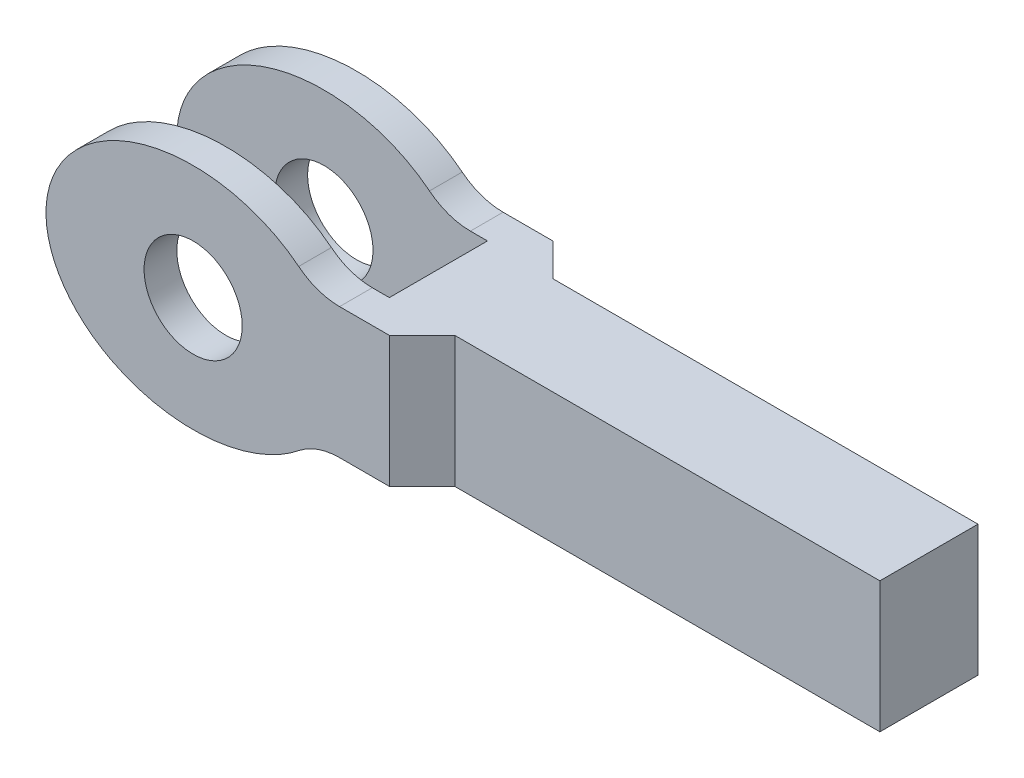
SolidWorks part; units mm, degrees
ref_plane "Płaszczyzna przednia" through (0, 0, 0) normal (0, 0, 1) x (1, 0, 0)
ref_plane "Płaszczyzna górna" through (0, 0, 0) normal (0, 1, 0) x (1, 0, 0)
ref_plane "Płaszczyzna prawa" through (0, 0, 0) normal (1, 0, 0) x (0, 0, -1)
sketch "Szkic1" plane through (0, 0, 0) normal (0, 0, 1) x (1, 0, 0)
  line L0 (4.4778, 2) -> (20, 2)
  line L1 (20, 2) -> (20, -2)
  line L2 (20, -2) -> (4.4778, -2)
  line L3 (0, 0) -> (20, 0) construction
  arc A1 (4.4778, -2) -> (3.2277, -2.4388) centre (4.4778, -4) ccw
  arc A2 (4.4778, 2) -> (3.2277, 2.4388) centre (4.4778, 4) cw
  circle A3 centre (0, 0) radius 1.5
  ellipse E0 centre (0, 0) end of major axis (-4.5, 0) minor radius 3.5 (3.2277, 2.4388) -> (3.2277, -2.4388) ccw
  point P12 (-1.5, 0)
  dimension "Promień" = 2
  dimension "Fi" = 3
  dimension "Długość" = 20
  dimension "Szerokość" = 4
  dimension "G" = 7
  dimension "h" = 3
extrude "Dodanie-wyciągnięcie1" add sketch "Szkic1" along normal mid plane 5
sketch "Szkic2" plane through (0, 0, 0) normal (0, 1, 0) x (1, 0, 0)
  line L0 (-4.5, 2.5) -> (-4.5, -2.5) construction
  line L1 (5, -1.5) -> (-5, -1.5)
  line L2 (5, -1.5) -> (5, 1.5)
  line L3 (5, 1.5) -> (-5, 1.5)
  line L4 (-5, -1.5) -> (-5, 1.5)
  line L5 (5, -1.5) -> (-5, 1.5) construction
  line L6 (5, 1.5) -> (-5, -1.5) construction
  point P0 (0, 0)
  dimension "D1" = 0.5
  dimension "Wycięcie" = 3
extrude "Wytnij-wyciągnięcie1" cut sketch "Szkic2" against normal through all both and the other way through all
sketch "Szkic3" plane through (0, 0, 0) normal (0, 1, 0) x (1, 0, 0)
  line L0 (6, 2.5) -> (7, 1.5)
  line L1 (20, 2.5) -> (4.4778, 2.5) construction
  line L2 (7, 1.5) -> (20, 1.5)
  line L3 (20, -2.5) -> (20, 2.5) construction
  line L4 (20, 1.5) -> (20, 2.5)
  line L5 (20, 2.5) -> (6, 2.5)
  line L6 (6, -2.5) -> (7, -1.5)
  line L7 (20, -2.5) -> (4.4778, -2.5) construction
  line L8 (7, -1.5) -> (20, -1.5)
  line L9 (20, -1.5) -> (20, -2.5)
  line L10 (20, -2.5) -> (6, -2.5)
  line L11 (0, 0) -> (20, 0) construction
  dimension "D1" = 45
  dimension "Grubość" = 3
  dimension "Odsunięcie" = 6
extrude "Wytnij-wyciągnięcie2" cut sketch "Szkic3" against normal through all both and the other way through all
